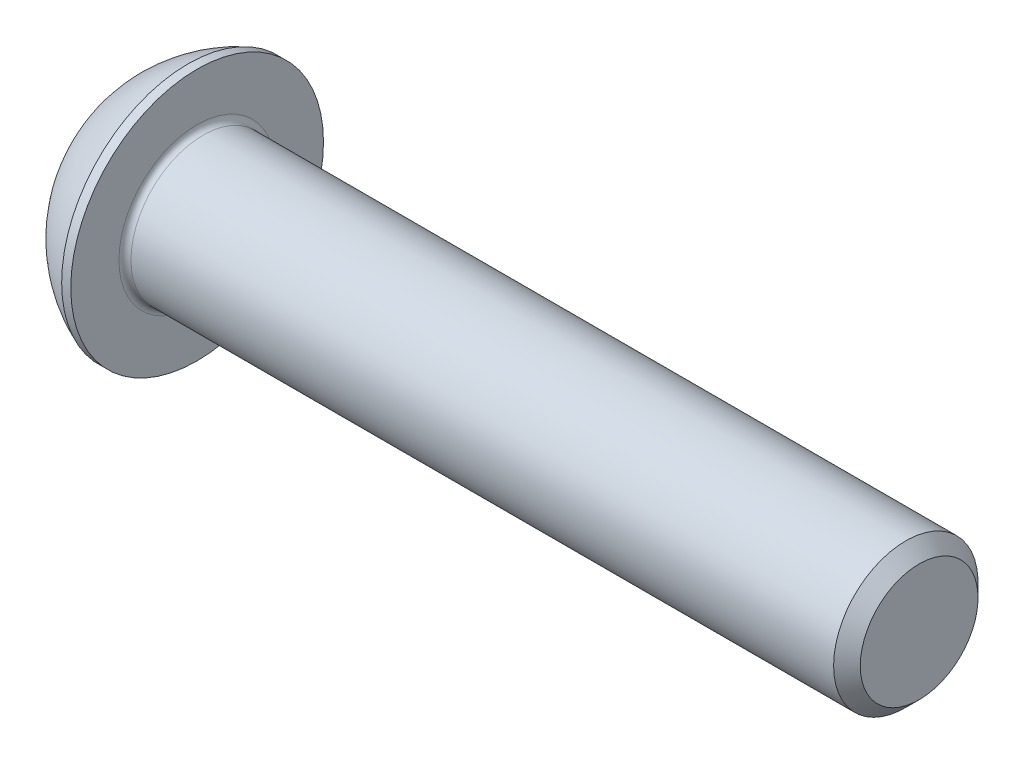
SolidWorks part; units mm, degrees
ref_plane "Plane1" through (0, 0, 0) normal (0, 0, 1) x (1, 0, 0)
ref_plane "Plane2" through (0, 0, 0) normal (0, 1, 0) x (1, 0, 0)
ref_plane "Plane3" through (0, 0, 0) normal (1, 0, 0) x (0, 0, -1)
other "Configuration Table"
sketch "BodySke" plane through (0, 0, 0) normal (0, 0, 1) x (1, 0, 0)
  line L0 (33.3, 0) -> (33.3, 2.4455)
  line L1 (32.7455, 3) -> (3.3, 3)
  line L2 (3.3, 3) -> (3.3, 5.25)
  line L3 (3.3, 5.25) -> (2.92, 5.25)
  line L4 (0, 0) -> (101.6, 0) construction
  line L5 (3.3, -5.25) -> (2.92, -5.25) construction
  line L6 (55.6768, -3) -> (3.3, -3) construction
  line L7 (33.3, 0) -> (0, 0)
  line L8 (0, 2.625) -> (0, -2.625) construction
  line L9 (0, 0) -> (0, 2.625)
  line L10 (33.3, 2.4455) -> (32.7455, 3)
  line L11 (33.3, -2.4455) -> (32.7455, -3) construction
  line L12 (4.3, 9.525) -> (4.3, -3) construction
  line L13 (3.3, 9.525) -> (3.3, -3) construction
  arc A1 (0, 2.625) -> (2.92, 5.25) centre (4.9997, 0) cw
revolve "BaseBody" add sketch "BodySke" angle 360 about L4
fillet "Fillet1" radius 0.25 1 edges at (3.3, 0, 3)
sketch "Sketch2" plane through (0, 0, 0) normal (0, 0, 1) x (1, 0, 0)
  line L0 (0, 2) -> (2.08, 2)
  line L1 (2.08, 2) -> (3.2347, 0)
  line L3 (3.2347, 0) -> (0, 0)
  line L4 (0, 0) -> (0, 2)
  line L5 (0, -2) -> (2.08, -2) construction
  line L6 (0, 0) -> (47.625, 0) construction
  dimension "D2" = 60
  dimension "PreBroach_depth" = 2.08
  dimension "PreBroach_dia" = 4
revolve "PreBroach" cut sketch "Sketch2" angle 360 about L6
sketch "Sketch3" plane through (0, 0, 0) normal (1, 0, 0) x (0, 0, -1)
  line L0 (-2, -1.1547) -> (-2, 1.1547)
  line L1 (-2, 1.1547) -> (0, 2.3094)
  line L2 (0, 2.3094) -> (2, 1.1547)
  line L3 (2, 1.1547) -> (2, -1.1547)
  line L4 (2, -1.1547) -> (0, -2.3094)
  line L5 (0, -2.3094) -> (-2, -1.1547)
extrude "Hex" cut sketch "Sketch3" along normal blind 2.08
sketch "ThdSchSke" plane through (0, 0, 0) normal (0, 0, 1) x (1, 0, 0)
  line L0 (5.3, -2.4455) -> (4.9117, -3)
  line L1 (5.3, -2.4455) -> (5.6883, -3)
  line L2 (5.6883, -3) -> (5.6883, -3.75)
  line L3 (-3.175, 0) -> (5.1513, 0) construction
  line L5 (5.6883, -3.75) -> (4.9117, -3.75)
  line L6 (4.9117, -3.75) -> (4.9117, -3)
revolve "ThreadSchematic" [suppressed] cut sketch "ThdSchSke" angle 360 about L3
pattern_linear "ThdSchPat" [suppressed]
equation "\"D1@BodySke\" = \"Head_dia@BodySke\" * .5"
equation "\"Thread_minor@ThreadCosmetic\" = \"Minor_dia@BodySke\""
equation "\"D1@Sketch3\" = \"Hex_size@Sketch3\" / 2"
equation "\"D2@Sketch3\" = \"D1@Sketch3\""
equation "\"D3@Sketch3\" = \"Hex_size@Sketch3\""
equation "\"Thread_length@ThreadCosmetic\" = ((sgn( (\"Length@BodySke\" - \"Advance@BodySke\" * 2.0) - \"Thread_nom@BodySke\" )-1)*( (\"Length@BodySke\" - \"Advance@BodySke\" * 2.0) - \"Thread_nom@BodySke\" ))/-2+ \"Thread_no"
equation "\"Thread_minor@ThdSchSke\" = \"Minor_dia@BodySke\""
equation "\"Diameter@ThdSchSke\" = \"Diameter@BodySke\""
equation "\"Overcut@ThdSchSke\" = \"Diameter@BodySke\" * 1.25"
equation "\"Start@ThdSchSke\" = \"Head_ht@BodySke\" + \"Length@BodySke\" - \"Thread_length@ThreadCosmetic\"  '---Non-countersunk---"
equation "\"Num_threads@ThdSchPat\" = int( \"Thread_length@ThreadCosmetic\" / \"Advance@BodySke\" + 0.999 )  + 1"
equation "\"Advance@ThdSchPat\" = \"Thread_length@ThreadCosmetic\" /  (\"Num_threads@ThdSchPat\" - 1) 'relax it"
equation "\"Num_threads@ThdSchPat\" = \"Num_threads@ThdSchPat\" - sgn( \"Num_threads@ThdSchPat\" - 1) '---chamfered tips only---"
